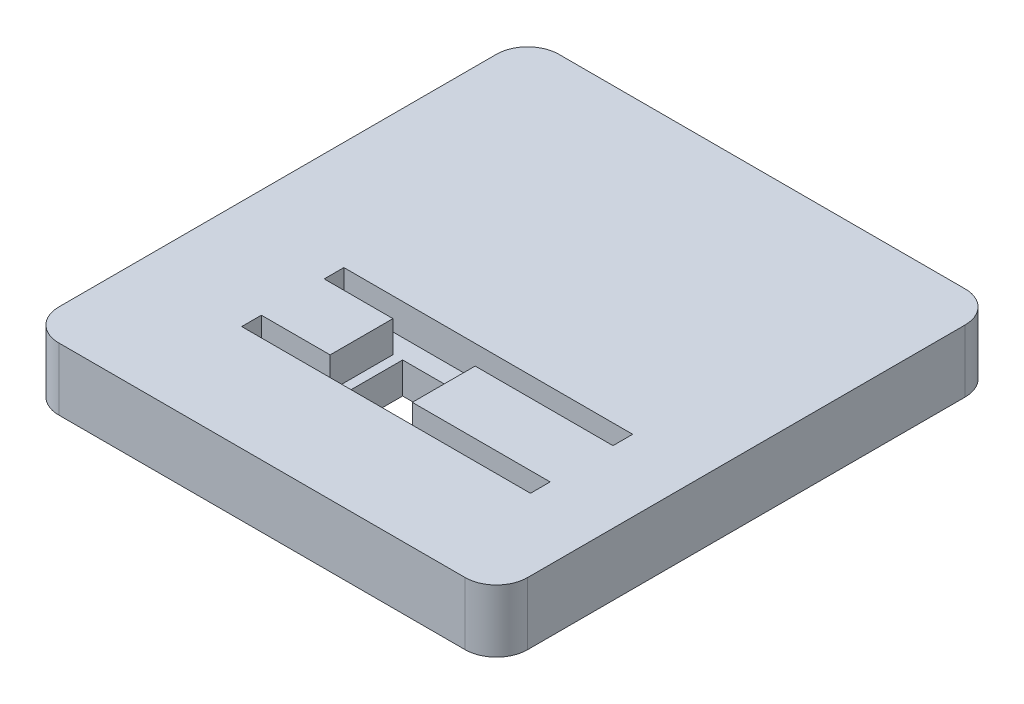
SolidWorks part; units mm, degrees
ref_plane "Plan de face" through (0, 0, 0) normal (0, 0, 1) x (1, 0, 0)
ref_plane "Plan de dessus" through (0, 0, 0) normal (0, 1, 0) x (1, 0, 0)
ref_plane "Plan de droite" through (0, 0, 0) normal (1, 0, 0) x (0, 0, -1)
sketch "Esquisse1" plane through (0, 0, 0) normal (0, 1, 0) x (1, 0, 0)
  line L1 (-37.5, 50) -> (37.5, 50)
  line L2 (-37.5, 50) -> (-37.5, -30)
  line L3 (-37.5, -30) -> (37.5, -30)
  line L4 (37.5, 50) -> (37.5, -30)
  point P0 (0, 0)
  dimension "D1" = 80
  dimension "D2" = 75
extrude "Boss.-Extru.1" add sketch "Esquisse1" along normal blind 10
sketch "Esquisse2" plane through (0, 10, 0) normal (0, 1, 0) x (1, 0, 0)
  line L0 (-37.5, -30) -> (37.5, -30) construction
  line L1 (-7.65, 0.15) -> (2.5, 0.15)
  line L2 (-7.65, 0.15) -> (-7.65, -10)
  line L3 (-7.65, -10) -> (2.5, -10)
  line L4 (2.5, 0.15) -> (2.5, -10)
  line L5 (-7.65, 0.15) -> (2.5, -10) construction
  line L6 (-7.65, -10) -> (2.5, 0.15) construction
  line L7 (37.5, -30) -> (37.5, 50) construction
  point P0 (0, 0)
  point P4 (0, 0)
  dimension "D1" = 10.15
  dimension "D2" = 10.15
  dimension "D3" = 20
  dimension "D4" = 35
extrude "Enlèv. mat.-Extru.1" cut sketch "Esquisse2" against normal blind 15
fillet "Congé1" radius 5 4 edges at (37.5, 5, 30) (-37.5, 5, 30) (37.5, 5, -50) (-37.5, 5, -50)
sketch "Esquisse4" plane through (0, 10, 0) normal (0, 1, 0) x (1, 0, 0)
  line L0 (-9.15, 3.2525) -> (26.0535, 3.2525)
  line L2 (26.0535, 3.2525) -> (26.0535, 0.1025)
  line L3 (26.0535, 0.1025) -> (4, 0.1025)
  line L4 (4, 0.1025) -> (4, -9.9475)
  line L5 (4, -9.9475) -> (26.0535, -9.9475)
  line L6 (26.0535, -9.9475) -> (26.0535, -13.0975)
  line L7 (26.0535, -13.0975) -> (-9.15, -13.0975)
  line L8 (-7.65, -10) -> (2.5, -10) construction
  line L9 (-9.15, -9.9475) -> (-9.15, 0.1025)
  line L10 (2.5, -10) -> (2.5, 0.15) construction
  line L11 (-7.65, 0.15) -> (2.5, 0.15)
  line L12 (-7.65, 0.15) -> (-7.65, -10)
  line L13 (-7.65, -10) -> (2.5, -10)
  line L14 (2.5, 0.15) -> (2.5, -10)
  line L16 (-9.15, 3.2525) -> (-20.15, 3.2525)
  line L17 (-20.15, 3.2525) -> (-20.15, 0.1025)
  line L18 (-20.15, 0.1025) -> (-9.15, 0.1025)
  line L19 (-9.15, -9.9475) -> (-20.15, -9.9475)
  line L20 (-20.15, -9.9475) -> (-20.15, -13.0975)
  line L21 (-20.15, -13.0975) -> (-9.15, -13.0975)
  dimension "D1" = 3.15
  dimension "D2" = 3.15
  dimension "D3" = 11
  dimension "D4" = 11
  dimension "D5" = 10.15
  dimension "D6" = 3.1025
  dimension "D7" = 1.5
  dimension "D8" = 0
  dimension "D9" = 0
  dimension "D10" = 3.15
  dimension "D11" = 3.15
  dimension "D12" = 10.05
extrude "Enlèv. mat.-Extru.2" cut sketch "Esquisse4" against normal blind 5
